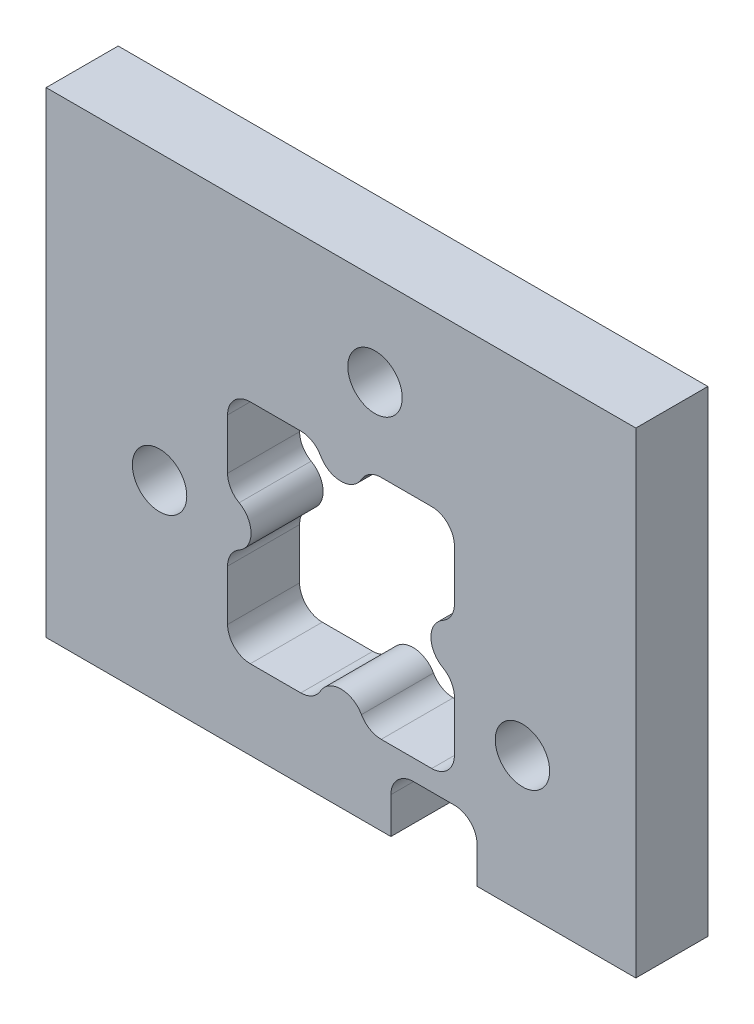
SolidWorks part; units mm, degrees
ref_plane "Front Plane" through (0, 0, 0) normal (0, 0, 1) x (1, 0, 0)
ref_plane "Top Plane" through (0, 0, 0) normal (0, 1, 0) x (1, 0, 0)
ref_plane "Right Plane" through (0, 0, 0) normal (1, 0, 0) x (0, 0, -1)
sketch "Sketch1" plane through (0, 0, 0) normal (0, 0, 1) x (1, 0, 0)
  line L0 (-13.784, -12.7561) -> (1.416, -12.7561)
  line L1 (-13.784, 8.2439) -> (12.216, 8.2439)
  line L2 (-13.784, 8.2439) -> (-13.784, -12.7561)
  line L3 (1.416, -12.7561) -> (1.416, -10.1561)
  line L4 (12.216, 8.2439) -> (12.216, -12.7561)
  line L5 (1.416, -10.1561) -> (5.216, -10.1561)
  line L6 (5.216, -10.1561) -> (5.216, -12.7561)
  line L7 (5.216, -12.7561) -> (12.216, -12.7561)
  dimension "D1" = 26
  dimension "D2" = 21
  dimension "D3" = 2.6
  dimension "D4" = 3.8
  dimension "D5" = 7
extrude "Boss-Extrude1" add sketch "Sketch1" along normal blind 3.175
sketch "Sketch2" plane through (0, 0, 3.175) normal (0, 0, 1) x (1, 0, 0)
  line L0 (-0.784, 0.7439) -> (-0.784, -9.2561) construction
  line L1 (-5.784, -9.2561) -> (4.216, -9.2561) construction
  line L2 (-5.784, -9.2561) -> (-5.784, 0.7439) construction
  line L3 (-5.784, 0.7439) -> (4.216, 0.7439) construction
  line L4 (4.216, -9.2561) -> (4.216, 0.7439) construction
  line L5 (-5.784, -9.2561) -> (4.216, 0.7439) construction
  line L6 (-5.784, 0.7439) -> (4.216, -9.2561) construction
  line L7 (-5.784, -4.2561) -> (4.216, -4.2561) construction
  line L8 (-0.784, 0.7439) -> (4.216, -4.2561) construction
  line L9 (4.216, -4.2561) -> (-0.784, -9.2561) construction
  line L10 (-0.784, -9.2561) -> (-5.784, -4.2561) construction
  line L11 (-5.784, -4.2561) -> (-0.784, 0.7439) construction
  line L12 (4.216, -9.2561) -> (0.2516, -9.2561)
  line L13 (-1.8195, -9.2561) -> (-5.784, -9.2561)
  line L14 (-5.784, 0.7439) -> (-1.8195, 0.7439)
  line L15 (0.2516, 0.7439) -> (4.216, 0.7439)
  line L16 (4.216, 0.7439) -> (4.216, -3.2206)
  line L17 (4.216, -5.2917) -> (4.216, -9.2561)
  line L19 (12.216, 8.2439) -> (-13.784, 8.2439) construction
  line L20 (-5.784, -9.2561) -> (-5.784, -5.2917)
  line L21 (-5.784, -3.2206) -> (-5.784, 0.7439)
  line L22 (-13.784, 8.2439) -> (-13.784, -12.7561) construction
  arc A0 (0.2516, 0.7439) -> (-1.8195, 0.7439) centre (-0.784, 0.7439) cw
  arc A1 (4.216, -5.2917) -> (4.216, -3.2206) centre (4.216, -4.2561) cw
  arc A2 (-1.8195, -9.2561) -> (0.2516, -9.2561) centre (-0.784, -9.2561) cw
  circle A3 centre (1.716, -1.7561) radius 2.5 construction
  circle A4 centre (-3.284, -1.7561) radius 2.5 construction
  circle A5 centre (1.716, -6.7561) radius 2.5 construction
  arc A6 (-5.784, -3.2206) -> (-5.784, -5.2917) centre (-5.784, -4.2561) cw
  point P0 (-0.784, -4.2561)
  dimension "D1" = 10
  dimension "D2" = 10
  dimension "D3" = 8
  dimension "D4" = 7.5
extrude "Cut-Extrude1" cut sketch "Sketch2" against normal through all
fillet "Fillet1" radius 1 12 edges at (-1.8195, 0.7439, 1.5875) (0.2516, 0.7439, 1.5875) (4.216, 0.7439, 1.5875) (4.216, -3.2206, 1.5875) (4.216, -5.2917, 1.5875) (4.216, -9.2561, 1.5875) (0.2516, -9.2561, 1.5875) (-1.8195, -9.2561, 1.5875) (-5.784, -9.2561, 1.5875) (-5.784, -5.2917, 1.5875) (-5.784, -3.2206, 1.5875) (-5.784, 0.7439, 1.5875)
sketch "Sketch3" plane through (0, 0, 3.175) normal (0, 0, 1) x (1, 0, 0)
  line L0 (4.216, -8.2561) -> (4.216, -6.0291) construction
  line L1 (-5.784, -6.0291) -> (-5.784, -8.2561) construction
  line L2 (-4.784, -9.2561) -> (-2.5569, -9.2561) construction
  line L4 (0.989, -9.2561) -> (3.216, -9.2561) construction
  line L5 (3.216, 0.7439) -> (0.989, 0.7439) construction
  line L6 (4.216, -2.4832) -> (4.216, -0.2561) construction
  circle A0 centre (7.216, -6.7561) radius 1.2
  circle A1 centre (0.716, 4.2439) radius 1.2
  circle A3 centre (-8.784, -4.2561) radius 1.2
  dimension "D1" = 2.4
  dimension "D2" = 2.4
  dimension "D3" = 2.5
  dimension "D4" = 2.4
  dimension "D5" = 3.5
  dimension "D6" = 3
  dimension "D7" = 5
  dimension "D8" = 3.5
  dimension "D9" = 3
extrude "Cut-Extrude2" cut sketch "Sketch3" against normal through all
fillet "Fillet2" radius 1 2 edges at (5.216, -10.1561, 1.5875) (1.416, -10.1561, 1.5875)
